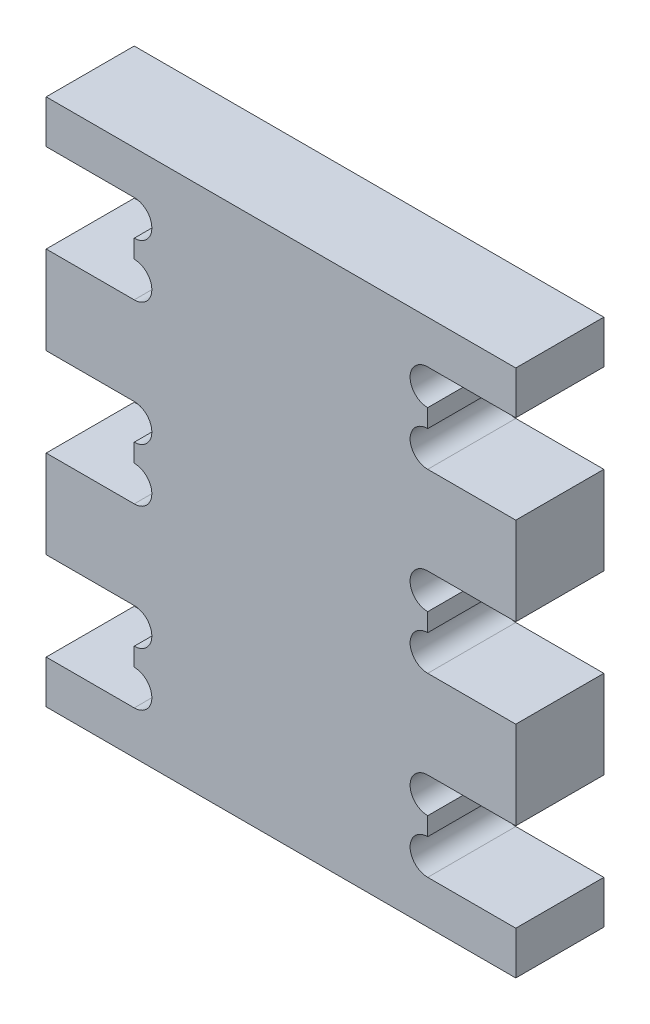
SolidWorks part; units mm, degrees
ref_plane "Ebene vorne" through (0, 0, 0) normal (0, 0, 1) x (1, 0, 0)
ref_plane "Ebene oben" through (0, 0, 0) normal (0, 1, 0) x (1, 0, 0)
ref_plane "Ebene rechts" through (0, 0, 0) normal (1, 0, 0) x (0, 0, -1)
sketch "Skizze1" plane through (0, 0, 0) normal (0, 0, 1) x (1, 0, 0)
  line L0 (0, 0) -> (50, 0)
  line L1 (50, 0) -> (65, 0)
  line L2 (65, 0) -> (65, 7.35)
  line L3 (65, 7.35) -> (50, 7.35)
  line L4 (50, 13.35) -> (50, 16.45)
  line L5 (50, 22.45) -> (65, 22.45)
  line L6 (65, 22.45) -> (65, 37.45)
  line L7 (65, 37.45) -> (50, 37.45)
  line L8 (50, 43.45) -> (50, 46.55)
  line L9 (50, 52.55) -> (65, 52.55)
  line L10 (65, 52.55) -> (65, 67.55)
  line L11 (65, 67.55) -> (50, 67.55)
  line L12 (50, 73.55) -> (50, 76.65)
  line L13 (50, 82.65) -> (65, 82.65)
  line L14 (65, 82.65) -> (65, 90)
  line L15 (65, 90) -> (48.734, 90)
  line L16 (48.734, 90) -> (0, 90)
  line L17 (-15, 90) -> (0, 90)
  line L18 (-15, 90) -> (-15, 82.65)
  line L19 (-15, 82.65) -> (0, 82.65)
  line L20 (0, 76.65) -> (0, 73.55)
  line L21 (0, 67.55) -> (-15, 67.55)
  line L22 (-15, 67.55) -> (-15, 52.55)
  line L23 (-15, 52.55) -> (0, 52.55)
  line L24 (0, 46.55) -> (0, 43.45)
  line L25 (0, 37.45) -> (-15, 37.45)
  line L26 (-15, 37.45) -> (-15, 22.45)
  line L27 (-15, 22.45) -> (0, 22.45)
  line L28 (0, 16.45) -> (0, 13.35)
  line L29 (0, 7.35) -> (-15, 7.35)
  line L30 (-15, 7.35) -> (-15, 0)
  line L31 (-15, 0) -> (0, 0)
  arc A0 (50, 7.35) -> (50, 13.35) centre (50, 10.35) cw
  arc A1 (50, 16.45) -> (50, 22.45) centre (50, 19.45) cw
  arc A2 (50, 37.45) -> (50, 43.45) centre (50, 40.45) cw
  arc A3 (50, 52.55) -> (50, 46.55) centre (50, 49.55) ccw
  arc A4 (50, 67.55) -> (50, 73.55) centre (50, 70.55) cw
  arc A5 (50, 76.65) -> (50, 82.65) centre (50, 79.65) cw
  arc A6 (0, 82.65) -> (0, 76.65) centre (0, 79.65) cw
  arc A7 (0, 73.55) -> (0, 67.55) centre (0, 70.55) cw
  arc A8 (0, 52.55) -> (0, 46.55) centre (0, 49.55) cw
  arc A9 (0, 43.45) -> (0, 37.45) centre (0, 40.45) cw
  arc A10 (0, 22.45) -> (0, 16.45) centre (0, 19.45) cw
  arc A11 (0, 13.35) -> (0, 7.35) centre (0, 10.35) cw
  dimension "D7" = 3
  dimension "D8" = 3
  dimension "D9" = 3
  dimension "D10" = 3
  dimension "D11" = 3
  dimension "D12" = 3
  dimension "D17" = 3
  dimension "D18" = 3
  dimension "D19" = 3
  dimension "D20" = 3
  dimension "D21" = 3
  dimension "D22" = 3
  dimension "D1" = 50
  dimension "D2" = 15
  dimension "D3" = 15
  dimension "D4" = 15.1
  dimension "D5" = 15
  dimension "D6" = 15.1
  dimension "D13" = 15
  dimension "D14" = 15.1
  dimension "D15" = 90
  dimension "D16" = 7.35
  dimension "D23" = 15
  dimension "D24" = 15
  dimension "D25" = 15
  dimension "D26" = 15
  dimension "D27" = 15
  dimension "D28" = 15
  dimension "D29" = 15
  dimension "D30" = 15
  dimension "D31" = 15.1
  dimension "D32" = 15
  dimension "D33" = 15.1
extrude "Aufsatz-Linear austragen1" add sketch "Skizze1" along normal blind 15
